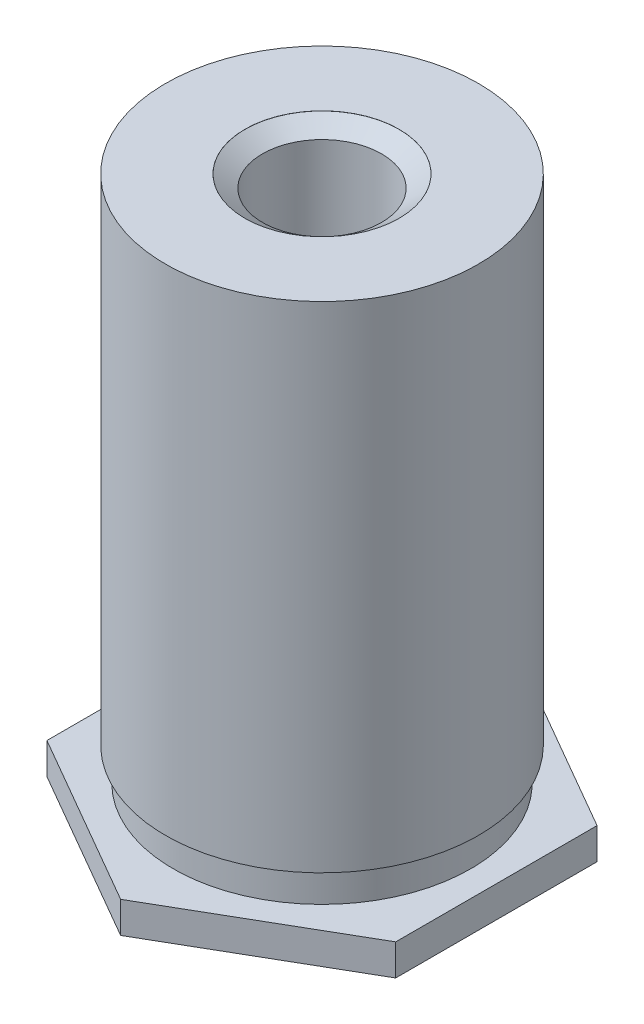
SolidWorks part; units mm, degrees
ref_plane "Plane1" through (0, 0, 0) normal (0, 0, 1) x (1, 0, 0)
ref_plane "Plane2" through (0, 0, 0) normal (0, 1, 0) x (1, 0, 0)
ref_plane "Plane3" through (0, 0, 0) normal (1, 0, 0) x (0, 0, -1)
sketch "BodySke" plane through (0, 0, 0) normal (0, 0, 1) x (1, 0, 0)
  line L0 (3.556, 0) -> (4.5964, 0)
  line L1 (4.5964, 0) -> (4.5964, 0.7112)
  line L2 (4.5964, 0.7112) -> (3.3782, 0.7112)
  line L3 (1.3525, 12.7) -> (1.3526, 6.35)
  line L4 (3.556, 1.458) -> (3.3782, 1.458)
  line L5 (3.3782, 1.458) -> (3.3782, 0.7112)
  line L6 (3.556, 0.0025) -> (3.556, 0)
  line L7 (1.016, 11.9075) -> (3.6522, 11.9075) construction
  line L8 (3.556, 12.7) -> (1.3525, 12.7)
  line L9 (0, 0) -> (0, 15.24) construction
  line L10 (3.556, 0.0025) -> (0, 0.0025)
  line L11 (3.556, 12.7) -> (3.556, 1.458)
  line L12 (0, 6.35) -> (1.3526, 6.35)
  line L13 (0, 6.35) -> (0, 0.0025)
  line L14 (1.016, 6.35) -> (3.6522, 6.35) construction
  line L15 (1.016, 6.35) -> (3.6522, 6.35) construction
  dimension "D1" = 0.0025
  dimension "E_dia" = 9.1928
  dimension "C_dia" = 7.112
  dimension "Thread_min" = 2.7051
  dimension "Clinching_ht" = 0.7112
  dimension "Advance" = 0.7925
  dimension "Length" = 12.7
  dimension "Thread_limit" = 6.35
  dimension "Thread_depth" = 6.35
  dimension "Drill_depth" = 6.35
  dimension "Groove_wid" = 0.7468
  dimension "Groove_dia" = 6.7564
revolve "Body" add sketch "BodySke"
revolve "EndChamfer" cut sketch "EndChamferSke" angle 360 about L0
sketch "EndChamferSke" plane through (0, 0, 0) normal (0, 0, 1) x (1, 0, 0)
  line L0 (0, -2.54) -> (0, 7.62) construction
  line L1 (0, 0) -> (0, 15.24) construction
  line L6 (1.7526, 12.6975) -> (1.3525, 12.4174)
  line L7 (1.7526, 12.6975) -> (1.7526, 12.954)
  line L8 (1.3525, 12.4174) -> (1.3525, 12.954)
  line L9 (1.7526, 12.954) -> (1.3525, 12.954)
  line L10 (3.556, 12.7) -> (-3.556, 12.7) construction
  dimension "D1" = 0.254
  dimension "Thread_nominal" = 3.5052
  dimension "D2" = 34.99
  dimension "Thread_min" = 2.7051
  dimension "Inset" = 0.0025
revolve "TapDrill" cut sketch "TapDriSke" angle 360 about L0
sketch "TapDriSke" plane through (0, 0, 0) normal (0, 0, 1) x (1, 0, 0)
  line L0 (0, 0) -> (0, 15.24) construction
  line L1 (0, 0) -> (0, 15.24) construction
  line L2 (1.3525, 2.3876) -> (1.3525, 12.7)
  line L3 (3.556, 12.7) -> (-3.556, 12.7) construction
  line L4 (1.3525, 2.3876) -> (0, 1.8274)
  line L5 (0, 1.8274) -> (0, 12.7)
  line L6 (0, 12.7) -> (1.3525, 12.7)
  line L7 (1.3525, 6.35) -> (1.3525, 12.7) construction
  line L8 (0, 1.8274) -> (-1.3525, 2.3876) construction
  line L9 (-1.3525, 12.7) -> (-1.3525, 6.35) construction
  line L10 (0, 1.458) -> (4.826, 1.458) construction
  dimension "D1" = 135
  dimension "Depth" = 10.3124
  dimension "Drill_limit" = 11.242
ref_plane "Plane4" through (0, -0.5486, 0) normal (0, 1, 0) x (-1, 0, 0)
sketch "ThdSchSke" plane through (0, 0, 0) normal (0, 0, 1) x (1, 0, 0)
  line L0 (0, -5.08) -> (0, 7.62) construction
  line L1 (0, 0) -> (0, 15.24) construction
  line L2 (0, 12.6975) -> (1.7526, 12.6975) construction
  line L3 (1.7526, 12.6975) -> (-1.7526, 12.6975) construction
  line L4 (1.7526, 12.6975) -> (1.3525, 12.9776)
  line L6 (1.7526, 12.6975) -> (1.3526, 12.4173)
  line L7 (1.3525, 12.9776) -> (1.3526, 12.4173)
  dimension "Vee_angle" = 70
  dimension "Thread_nominal" = 3.5052
  dimension "Thread_min" = 2.7051
revolve "ThreadSchematic" [suppressed] cut sketch "ThdSchSke" angle 360 about L0
pattern_linear "ThdSchPat" [suppressed]
sketch "HexDieSke" plane through (0, 0.7112, 0) normal (0, 1, 0) x (-1, 0, 0)
  line L0 (0, 4.5754) -> (3.9624, 2.2877)
  line L1 (3.9624, 2.2877) -> (3.9624, -2.2877)
  line L2 (3.9624, -2.2877) -> (0, -4.5754)
  line L3 (0, -4.5754) -> (-3.9624, -2.2877)
  line L4 (-3.9624, -2.2877) -> (-3.9624, 2.2877)
  line L5 (-3.9624, 2.2877) -> (0, 4.5754)
  circle A1 centre (0, 0) radius 3.9624 construction
  circle A2 centre (0, 0) radius 4.5754 construction
  circle A3 centre (0, 0) radius 4.6091
  dimension "Width_across_flats" = 7.9248
  dimension "OD" = 9.2182
extrude "HexDie" cut sketch "HexDieSke" against normal blind 0.7112
equation "' \"Length@BodySke\" = 0.75"
equation "' \"C_dia@BodySke\" = 0.28"
equation "' \"Width_across_flats@HexDieSke\" = 0.312"
equation "' \"Thread_depth@BodySke\" = 0.375"
equation "' \"Advance@BodySke\" = 0.0312"
equation "' \"Thread_min@BodySke\" = 0.1528"
equation "' \"Thread_nominal@ThreadCosmetic\" = 0.19"
equation "\"E_dia@BodySke\" = \"Width_across_flats@HexDieSke\" * 1.16"
equation "\"Clinching_ht@BodySke\" = \"C_dia@BodySke\" * 0.1"
equation "\"Groove_dia@BodySke\" = \"C_dia@BodySke\" * 0.95"
equation "\"Groove_wid@BodySke\" = \"Clinching_ht@BodySke\" * 1.05"
equation "\"Drill_depth@BodySke\" = \"Thread_depth@BodySke\""
equation "\"Drill_limit@TapDriSke\" = \"Length@BodySke\" - \"Clinching_ht@BodySke\" - \"Groove_wid@BodySke\""
equation "\"Thread_limit@BodySke\" = ((sgn( \"Length@BodySke\" - \"Thread_depth@BodySke\" )-1)*( \"Length@BodySke\" - \"Thread_depth@BodySke\" ))/-2+ \"Thread_depth@BodySke\""
equation "\"Depth@TapDriSke\" = \"Thread_limit@BodySke\" + \"Advance@BodySke\" * 5"
equation "\"Depth@TapDriSke\" = ((sgn( \"Depth@TapDriSke\" - \"Drill_limit@TapDriSke\" )-1)*( \"Depth@TapDriSke\" - \"Drill_limit@TapDriSke\" ))/-2+ \"Drill_limit@TapDriSke\""
equation "\"Depth@HexDie\" = \"Clinching_ht@BodySke\""
equation "\"OD@HexDieSke\" =  \"Width_across_flats@HexDieSke\" * 1.16 + 0.001"
equation "\"Thread_nominal@EndChamferSke\" = \"Thread_nominal@ThreadCosmetic\""
equation "\"Thread_min@EndChamferSke\" = \"Thread_min@BodySke\""
equation "\"D2@EndChamferSke\" = \"Vee_angle@ThdSchSke\" / 2 - 0.01"
equation "\"Thread_nominal@ThdSchSke\" = \"Thread_nominal@ThreadCosmetic\""
equation "\"Thread_min@ThdSchSke\" = \"Thread_min@BodySke\""
equation "\"Num_threads@ThdSchPat\" = int(  ( \"Thread_limit@BodySke\" - \"Inset@EndChamferSke\" ) / \"Advance@BodySke\" + 0.999 )  + 1"
equation "\"Advance@ThdSchPat\" = (  \"Thread_limit@BodySke\" - \"Inset@EndChamferSke\" ) /  (\"Num_threads@ThdSchPat\" - 1) 'relax it"
